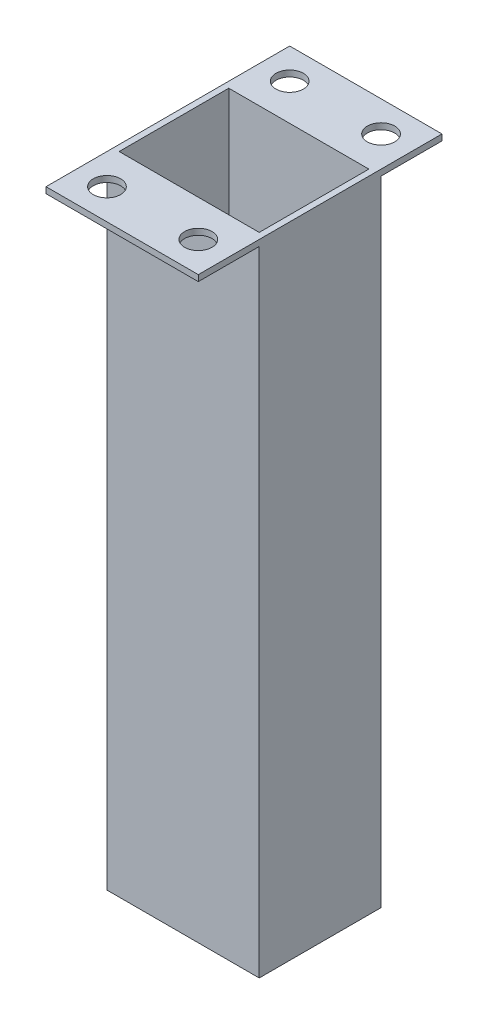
SolidWorks part; units mm, degrees
ref_plane "前视基准面" through (0, 0, 0) normal (0, 0, 1) x (1, 0, 0)
ref_plane "上视基准面" through (0, 0, 0) normal (0, 1, 0) x (1, 0, 0)
ref_plane "右视基准面" through (0, 0, 0) normal (1, 0, 0) x (0, 0, -1)
sketch "草图1" plane through (0, 0, 0) normal (0, 0, 1) x (1, 0, 0)
  line L0 (0, 0) -> (0, 105)
  line L1 (25, 0) -> (25, 105)
  line L2 (0, 105) -> (25, 105)
  line L3 (0, 0) -> (25, 0)
extrude "凸台-拉伸1" add sketch "草图1" along normal blind 40
sketch "草图2" plane through (25, 0, 0) normal (1, 0, 0) x (0, 0, -1)
  line L0 (-30, 0) -> (-30, 104)
  line L1 (-10, 0) -> (-10, 104)
  line L2 (-40, 104) -> (-40, 105)
  line L3 (0, 104) -> (0, 105)
  line L4 (-40, 105) -> (0, 105)
  line L5 (-30, 0) -> (-10, 0)
  line L6 (-40, 104) -> (-30, 104)
  line L7 (-10, 104) -> (0, 104)
extrude "切除-拉伸1" cut sketch "草图2" against normal blind 40 flip side to cut
sketch "草图3" plane through (0, 105, 0) normal (0, 1, 0) x (1, 0, 0)
  circle A0 centre (5, -5) radius 2.25
  circle A1 centre (20, -5) radius 2.25
  circle A2 centre (5, -35) radius 2.25
  circle A3 centre (20, -35) radius 2.25
extrude "切除-拉伸2" cut sketch "草图3" against normal blind 40
sketch "草图4" plane through (0, 105, 0) normal (0, 1, 0) x (1, 0, 0)
  line L0 (24, -29) -> (24, -11)
  line L1 (1, -29) -> (1, -11)
  line L2 (1, -11) -> (24, -11)
  line L3 (1, -29) -> (24, -29)
  circle A0 centre (5, -5) radius 2.25
  circle A1 centre (20, -5) radius 2.25
  circle A2 centre (5, -35) radius 2.25
  circle A3 centre (20, -35) radius 2.25
extrude "切除-拉伸3" cut sketch "草图4" against normal through all
